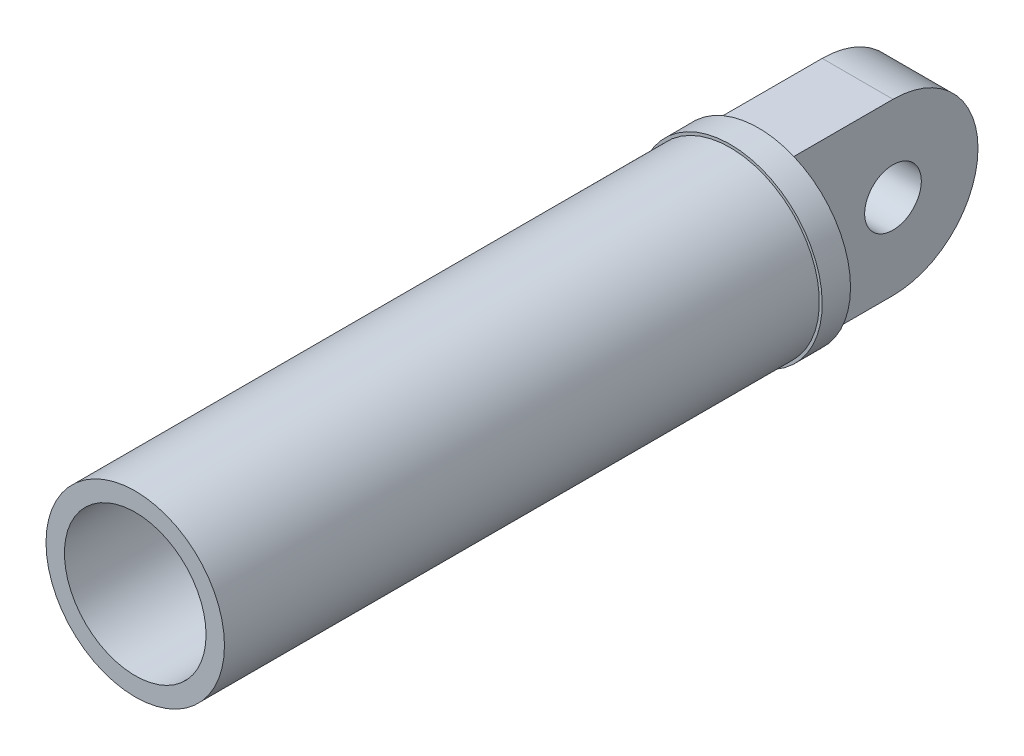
SolidWorks part; units mm, degrees
ref_plane "前视基准面" through (0, 0, 0) normal (0, 0, 1) x (1, 0, 0)
ref_plane "上视基准面" through (0, 0, 0) normal (0, 1, 0) x (1, 0, 0)
ref_plane "右视基准面" through (0, 0, 0) normal (1, 0, 0) x (0, 0, -1)
sketch "草图1" plane through (0, 0, 0) normal (0, 0, 1) x (1, 0, 0)
  circle A0 centre (0, 0) radius 31.5
  circle A1 centre (0, 0) radius 25
  dimension "D1" = 63
  dimension "D2" = 50
extrude "拉伸1" add sketch "草图1" along normal blind 210
sketch "草图2" plane through (0, 0, 0) normal (0, 0, -1) x (-1, 0, 0)
  circle A0 centre (0, 0) radius 32.5
  dimension "D1" = 65
extrude "拉伸2" add sketch "草图2" along normal blind 10
sketch "草图3" plane through (0, 0, 0) normal (1, 0, 0) x (0, 0, -1)
  line L0 (-45.8753, 0) -> (59.0311, 0) construction
  line L1 (10, -32.5) -> (10, 32.5) construction
  line L2 (45, 30) -> (10, 30)
  line L3 (45, -30) -> (10, -30)
  line L4 (10, -30) -> (10, 30)
  arc A0 (45, -30) -> (45, 30) centre (45, 0) ccw
  circle A1 centre (45, 0) radius 10
  dimension "D1" = 35
  dimension "D2" = 60
  dimension "D3" = 20
extrude "拉伸3" add sketch "草图3" along normal mid plane 25
sketch "草图4" plane through (0, 0, 0) normal (0, 0, 1) x (1, 0, 0)
  circle A1 centre (0, 0) radius 25
  circle A2 centre (0, 0) radius 25
  dimension "D1" = 0
extrude "拉伸4" add sketch "草图4" along normal blind 10
